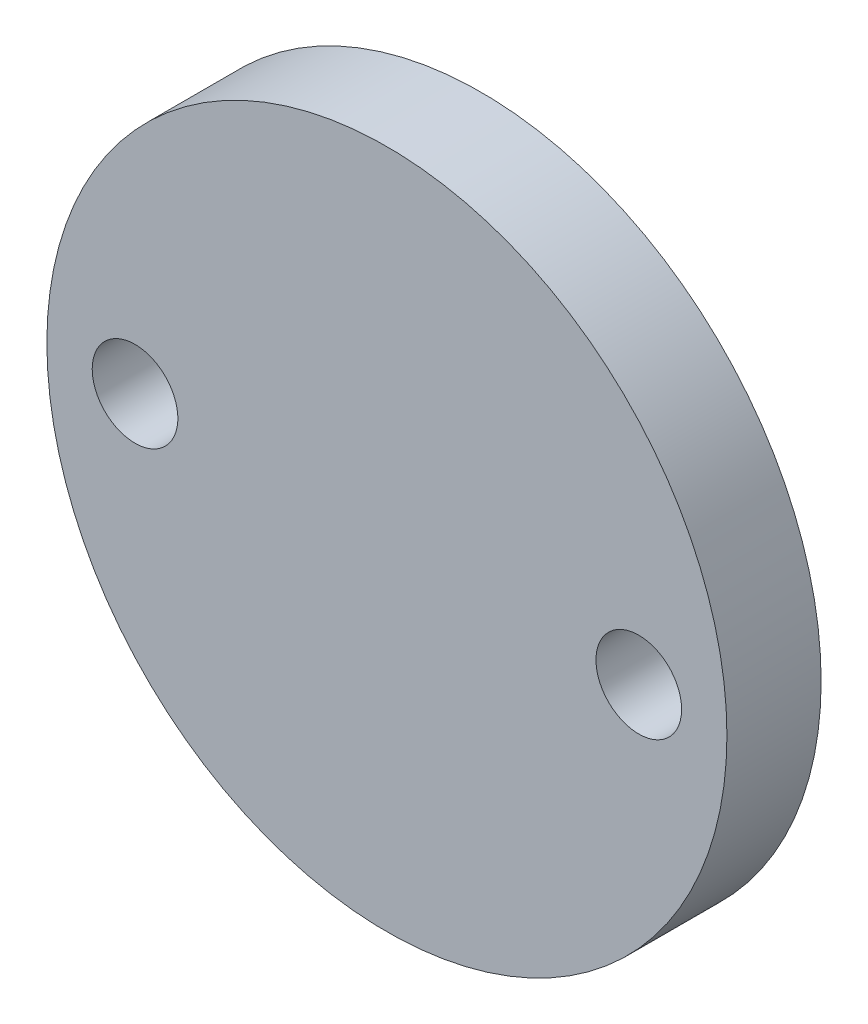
SolidWorks part; units mm, degrees
ref_plane "Plane1" through (0, 0, 0) normal (0, 0, 1) x (1, 0, 0)
ref_plane "Plane2" through (0, 0, 0) normal (0, 1, 0) x (1, 0, 0)
ref_plane "Plane3" through (0, 0, 0) normal (1, 0, 0) x (0, 0, -1)
sketch "Sketch1" plane through (0, 0, 0) normal (0, 0, 1) x (1, 0, 0)
  line L0 (-127.2718, 0) -> (136.9327, 0) construction
  line L1 (0, 87.3681) -> (0, -87.7881) construction
  circle A0 centre (0, 0) radius 17.145
  dimension "D1" = 34.29
extrude "Base-Extrude" add sketch "Sketch1" along normal blind 4.7498
sketch "Sketch2" plane through (0, 0, 4.7498) normal (0, 0, 1) x (1, 0, 0)
  line L0 (-23.7198, 0) -> (23.0527, 0) construction
  line L1 (0, 18.457) -> (0, -18.2346) construction
  circle A0 centre (12.7, 0) radius 2.159
  circle A1 centre (-12.7, 0) radius 2.159
  dimension "D1" = 4.318
  dimension "D2" = 12.7
extrude "Cut-Extrude1" cut sketch "Sketch2" against normal through all
sketch "Sketch5" plane through (0, 0, 4.7498) normal (0, 0, 1) x (1, 0, 0)
  line L0 (-31.0279, 0) -> (44.3983, 0) construction
